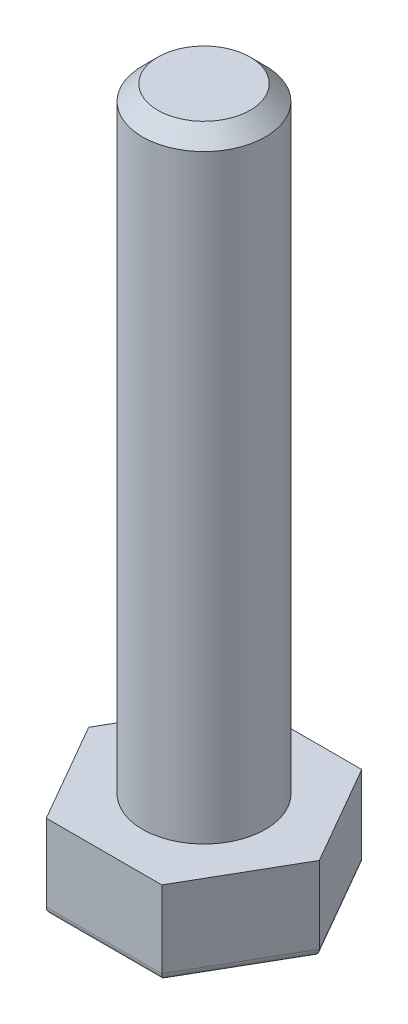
SolidWorks part; units mm, degrees
ref_plane "Plan de face" through (0, 0, 0) normal (0, 0, 1) x (1, 0, 0)
ref_plane "Plan de dessus" through (0, 0, 0) normal (0, 1, 0) x (1, 0, 0)
ref_plane "Plan de droite" through (0, 0, 0) normal (1, 0, 0) x (0, 0, -1)
sketch "Esquisse1" plane through (0, 0, 0) normal (0, 1, 0) x (1, 0, 0)
  line L0 (-7.5, 0) -> (7.5, 0) construction
  line L1 (0, -6.5) -> (0, 6.5) construction
  line L2 (-3.7583, 6.5) -> (3.7583, 6.5)
  line L3 (3.7583, 6.5) -> (7.5, 0)
  line L4 (-3.7583, 6.5) -> (-7.5, 0)
  line L5 (-3.7583, -6.5) -> (-7.5, 0)
  line L6 (3.7583, -6.5) -> (7.5, 0)
  line L7 (-3.7583, -6.5) -> (3.7583, -6.5)
  point P8 (0, 0)
  dimension "D1" = 13
  dimension "D2" = 13
  dimension "D3" = 15
extrude "Extrusion1" add sketch "Esquisse1" along normal blind 5.5
fillet "Congé1" radius 0.5 6 edges at (-5.6292, 0, 3.25) (-5.6292, 0, -3.25) (0, 0, -6.5) (5.6292, 0, -3.25) (5.6292, 0, 3.25) (0, 0, 6.5)
sketch "Esquisse2" plane through (0, 5.5, 0) normal (0, 1, 0) x (-1, 0, 0)
  circle A0 centre (0, 0) radius 4
  dimension "D1" = 8
extrude "Extrusion2" add sketch "Esquisse2" along normal blind 40
chamfer "Chanfrein1" distance 1 angle 45 1 edges at (0, 45.5, 4)
